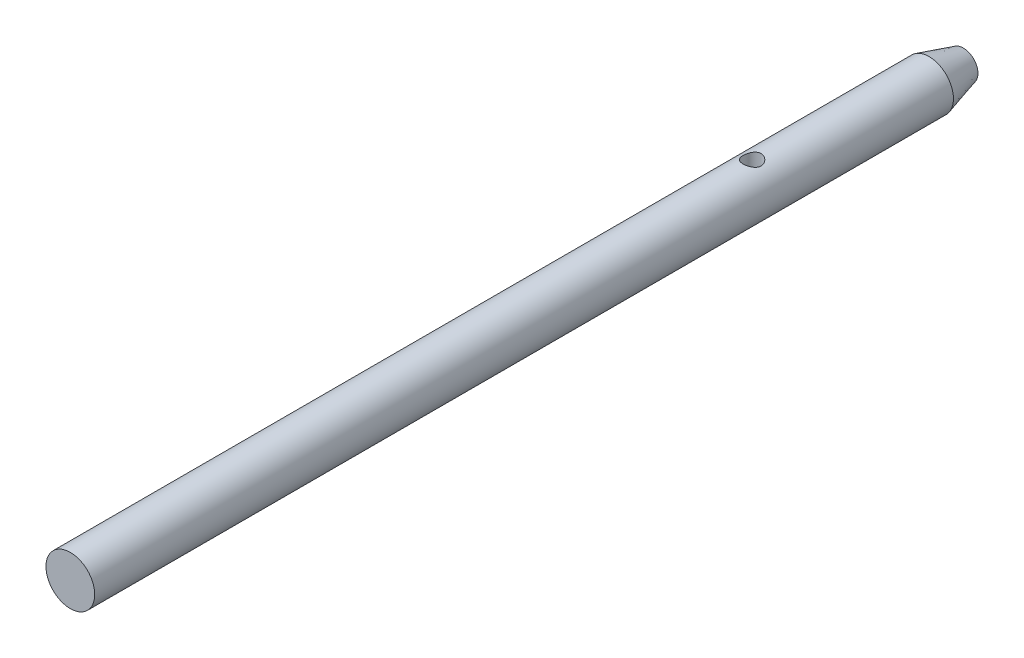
SolidWorks part; units mm, degrees
ref_plane "Plane1" through (0, 0, 0) normal (0, 0, 1) x (1, 0, 0)
ref_plane "Plane2" through (0, 0, 0) normal (0, 1, 0) x (1, 0, 0)
ref_plane "Plane3" through (0, 0, 0) normal (1, 0, 0) x (0, 0, -1)
sketch "Sketch1" plane through (0, 0, 0) normal (0, 0, 1) x (1, 0, 0)
  circle A0 centre (0, 0) radius 2.135
  dimension "D1" = 4.27
extrude "drive shaft shape" add sketch "Sketch1" along normal blind 78.2
chamfer "drive shaft chamfer" distance 0.85 distance2 3 1 edges at (2.135, 0, 0)
sketch "Sketch2" plane through (0, 0, 0) normal (0, 1, 0) x (1, 0, 0)
  line L0 (0, 0) -> (0, -88.6602) construction
  line L1 (0, -78.2) -> (0, -3) construction
  circle A0 centre (0, -18.5) radius 0.79
  dimension "D2" = 1.58
  dimension "D1" = 18.5
extrude "drive shaft pin hole" cut sketch "Sketch2" against normal up to next and the other way up to next
equation "\"result\"= 0.008774"
equation "\"result\"= 2*1"
equation "\"result\"= 1*1"
equation "\"result\"= 1.000000*3.750000"
